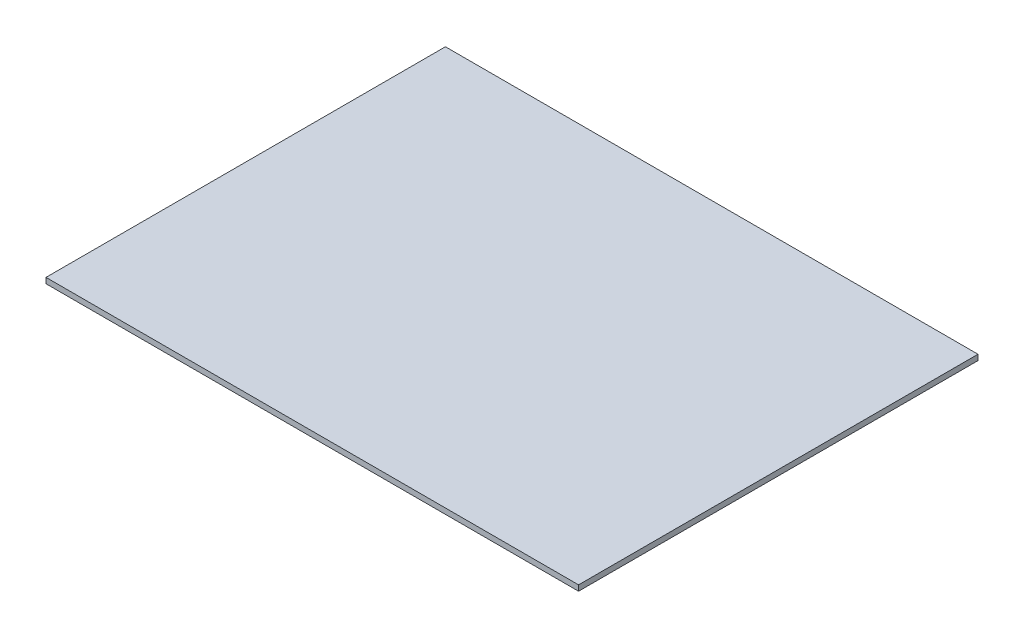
SolidWorks part; units mm, degrees
ref_plane "Front Plane" through (0, 0, 0) normal (0, 0, 1) x (1, 0, 0)
ref_plane "Top Plane" through (0, 0, 0) normal (0, 1, 0) x (1, 0, 0)
ref_plane "Right Plane" through (0, 0, 0) normal (1, 0, 0) x (0, 0, -1)
sketch "Sketch1" plane through (0, 0, 0) normal (0, 1, 0) x (1, 0, 0)
  line L1 (-286.6383, -76.2) -> (322.9617, -76.2)
  line L2 (-286.6383, -76.2) -> (-286.6383, -533.4)
  line L3 (-286.6383, -533.4) -> (322.9617, -533.4)
  line L4 (322.9617, -76.2) -> (322.9617, -533.4)
  dimension "D1" = 457.2
  dimension "D2" = 609.6
extrude "Boss-Extrude1" add sketch "Sketch1" along normal blind 6.35
